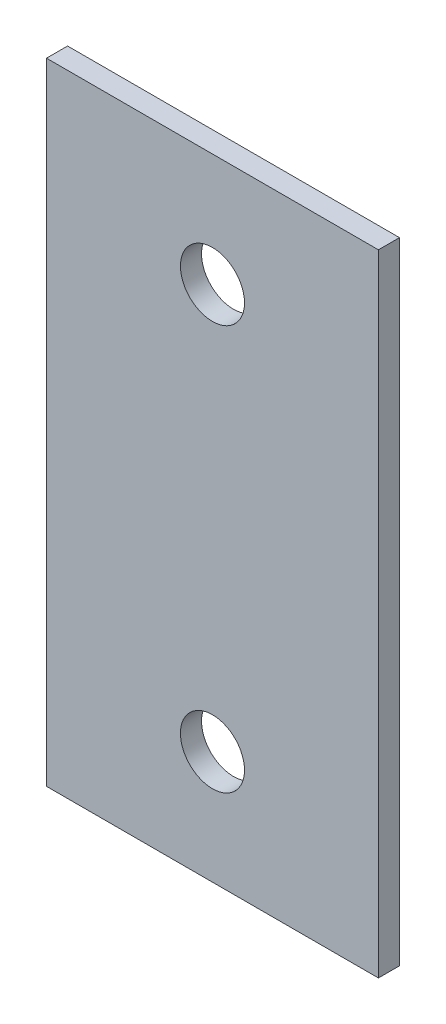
SolidWorks part; units mm, degrees
ref_plane "Front Plane" through (0, 0, 0) normal (1, 0, 0) x (0, 1, 0)
ref_plane "Top Plane" through (0, 0, 0) normal (0, 0, 1) x (0, 1, 0)
ref_plane "Right Plane" through (0, 0, 0) normal (0, 1, 0) x (-1, 0, 0)
sketch "Sketch1" plane through (0, 0, 0) normal (0, 0, 1) x (0, 1, 0)
  line L1 (-47.5, 25) -> (47.5, 25)
  line L2 (-47.5, 25) -> (-47.5, -25)
  line L3 (-47.5, -25) -> (47.5, -25)
  line L4 (47.5, 25) -> (47.5, -25)
  line L5 (-47.5, 25) -> (47.5, -25) construction
  line L6 (-47.5, -25) -> (47.5, 25) construction
  point P0 (0, 0)
  dimension "D1" = 50
  dimension "D2" = 95
extrude "Boss-Extrude1" add sketch "Sketch1" along normal mid plane 3.175
sketch "Sketch2" plane through (0, 0, 0) normal (0, 0, 1) x (0, 1, 0)
  line L0 (-30.48, 0) -> (30.48, 0) construction
  circle A0 centre (-30.48, 0) radius 4.826
  circle A1 centre (30.48, 0) radius 4.826
  point P4 (0, 0)
  dimension "D2" = 9.652
  dimension "D3" = 9.652
  dimension "D1" = 60.96
extrude "Cut-Extrude1" cut sketch "Sketch2" against normal through all both and the other way through all
